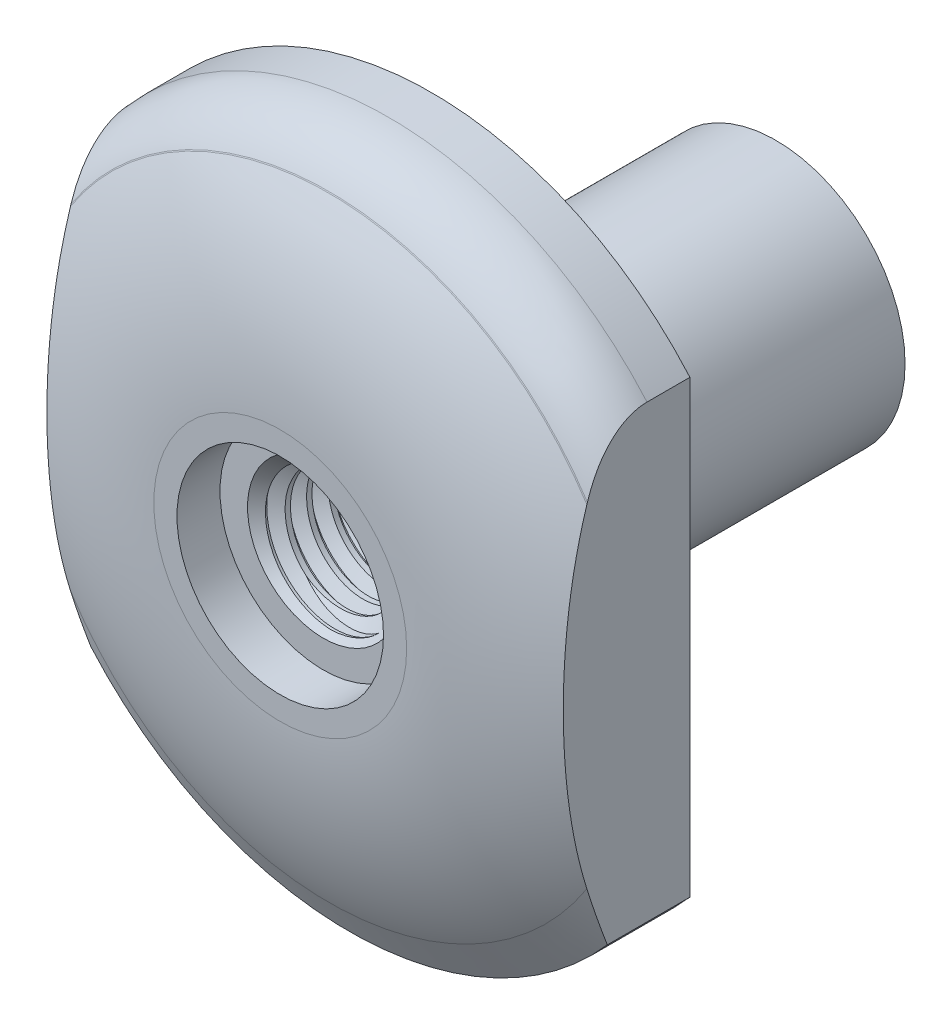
SolidWorks part; units mm, degrees
ref_plane "Спереди" through (0, 0, 0) normal (0, 0, 1) x (1, 0, 0)
ref_plane "Сверху" through (0, 0, 0) normal (0, 1, 0) x (1, 0, 0)
ref_plane "Справа" through (0, 0, 0) normal (1, 0, 0) x (0, 0, -1)
other "Configuration Table"
sketch "Эскиз1" plane through (0, 0, 0) normal (0, 0, 1) x (1, 0, 0)
  circle A0 centre (0, 0) radius 7.5
  dimension "D1" = 15
extrude "Бобышка-Вытянуть1" add sketch "Эскиз1" along normal blind 20
sketch "Эскиз2" plane through (0, 0, 20) normal (0, 0, 1) x (1, 0, 0)
  line L0 (0, 23.6336) -> (0, -23.1902) construction
  line L1 (-15, 13.0771) -> (-15, -13.0771)
  line L2 (15, 13.0771) -> (15, -13.0771)
  arc A0 (-15, -13.0771) -> (15, -13.0771) centre (0, 0) ccw
  arc A1 (15, 13.0771) -> (-15, 13.0771) centre (0, 0) ccw
  dimension "D1" = 39.8
  dimension "D2" = 30
extrude "Бобышка-Вытянуть6" add sketch "Эскиз2" along normal blind 2.8
sketch "Эскиз9" plane through (0, 0, 22.8) normal (0, 0, 1) x (1, 0, 0)
  line L0 (-15, 13.0771) -> (-15, -13.0771)
  line L1 (15, 13.0771) -> (15, -13.0771)
  line L2 (15, -13.0771) -> (15, 13.0771) construction
  arc A0 (-15, -13.0771) -> (15, -13.0771) centre (0, 0) ccw
  arc A1 (15, 13.0771) -> (-15, 13.0771) centre (0, 0) ccw
  dimension "D2" = 30
extrude "Бобышка-Вытянуть7" add sketch "Эскиз9" along normal blind 6
chamfer "Фаска2" distance 4 angle 60 1 edges at (0, -19.9, 28.8)
fillet "Скругление4" radius 4 1 edges at (0, 19.9, 24.8)
fillet "Скругление5" radius 21 1 edges at (12.9718, 0, 28.8)
sketch "Эскиз10" plane through (0, 0, 28.8) normal (0, 0, 1) x (1, 0, 0)
  circle A0 centre (0, 0) radius 6
  dimension "D1" = 12
extrude "Вырез-Вытянуть1" cut sketch "Эскиз10" against normal blind 2.5
sketch "Эскиз11" plane through (0, 0, 26.3) normal (0, 0, 1) x (1, 0, 0)
  circle A0 centre (0, 0) radius 3.4
  dimension "D1" = 6.8
extrude "Вырез-Вытянуть2" cut sketch "Эскиз11" against normal through all
sketch "Эскиз12" plane through (0, 0, 0) normal (0, 0, -1) x (-1, 0, 0)
  circle A0 centre (0, 0) radius 4.925
  dimension "D1" = 9.85
extrude "Вырез-Вытянуть4" cut sketch "Эскиз12" against normal blind 13.98
chamfer "Фаска5" distance 1 angle 45 2 edges at (-3.4, 0, 13.98) (3.4, 0, 26.3)
thread "Резьба2" pitch 1.25 start angle 0, offset 2, length 13, pitch 1.25, diameter 6.8
ref_plane "Плоскость2" through (-3.4, 0, 27.3) normal (0, -1, 0) x (-1, 0, 0)
sketch "Профиль резьбы2" plane through (-3.4, 0, 27.3) normal (0, -1, 0) x (-1, 0, 0)
  line L0 (0, 0) -> (0, 1.25) construction
  line L1 (0, 0) -> (0.6766, 0.3906)
  line L2 (0.6766, 0.3906) -> (0.6766, 0.5469)
  line L3 (0.6766, 0.5469) -> (0, 0.9375)
  line L4 (0.6766, 0.4687) -> (0, 0.4687) construction
  line L11 (0, 0) -> (0, 0.9375)
  point P2 (0, 0)
  dimension "Pitch" = 1.25
  dimension "Profile_Angle" = 60
  dimension "Profile_Land" = 0.1562
  dimension "Profile_Height" = 0.6766
sketch "Эскиз14" plane through (0, 0, 0) normal (0, 0, 1) x (1, 0, 0)
